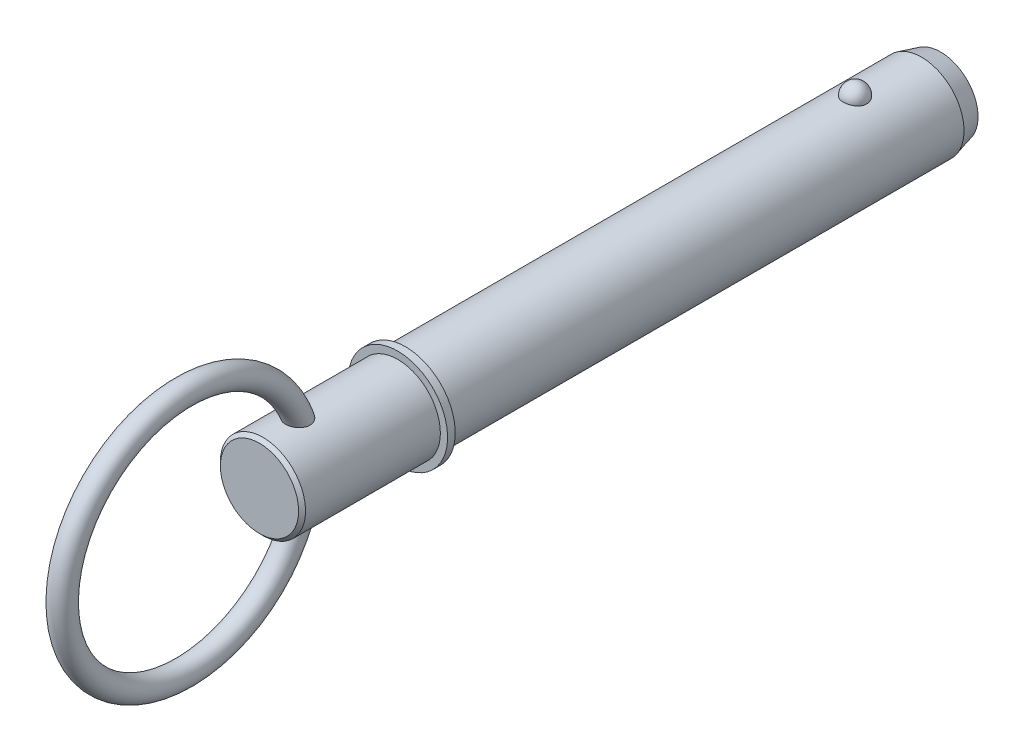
SolidWorks part; units mm, degrees
ref_plane "Front Plane" through (0, 0, 0) normal (0, 0, 1) x (1, 0, 0)
ref_plane "Top Plane" through (0, 0, 0) normal (0, 1, 0) x (1, 0, 0)
ref_plane "Right Plane" through (0, 0, 0) normal (1, 0, 0) x (0, 0, -1)
sketch "Sketch2" plane through (0, 0, 0) normal (0, 0, 1) x (1, 0, 0)
  circle A0 centre (0, 0) radius 11.115
  point P3 (0, 11.115)
  dimension "D1" = 22.23
extrude "Boss-Extrude1" add sketch "Sketch2" along normal blind 114.3
sketch "Sketch3" plane through (0, 0, 0) normal (0, 0, -1) x (-1, 0, 0)
  circle A0 centre (0, 0) radius 11.115
  dimension "D1" = 22.23
extrude "Boss-Extrude2" add sketch "Sketch3" along normal blind 25.4
chamfer "Chamfer1" distance 5 angle 15 1 edges at (-11.115, 0, -25.4)
sketch "Sketch18" plane through (0, 0, 0) normal (1, 0, 0) x (0, 0, -1)
  line L0 (20.4, 11.115) -> (-114.3, 11.115) construction
  line L1 (3.07, 14.185) -> (3.07, 8.045)
  line L2 (-114.3, -11.115) -> (20.4, -11.115) construction
  arc A0 (3.07, 14.185) -> (3.07, 8.045) centre (3.07, 11.115) ccw
  point P4 (0, 11.115)
  dimension "D1" = 25.3
revolve "Revolve1" add sketch "Sketch18" angle 360 about L1
sketch "Sketch19" plane through (0, 0, 0) normal (1, 0, 0) x (0, 0, -1)
  line L0 (-33.7288, 0) -> (-46.4542, 0) construction
sketch "Sketch20" plane through (0, 0, 0) normal (1, 0, 0) x (0, 0, -1)
  line L0 (-114.3, 0) -> (-114.3, 13)
  line L1 (-114.3, 11.115) -> (-114.3, -11.115) construction
  line L2 (-114.3, 13) -> (-116.3, 13)
  line L3 (-116.3, 13) -> (-116.3, 0)
  line L4 (-33.7288, 0) -> (-46.4542, 0) construction
  line L5 (-116.3, 0) -> (-114.3, 0)
  dimension "D1" = 13
  dimension "D2" = 2
revolve "Revolve2" add sketch "Sketch20" angle 360 about L0
sketch "Sketch21" plane through (0, 0, 114.3) normal (0, 0, -1) x (-1, 0, 0)
  circle A0 centre (0, 0) radius 11.115
  dimension "D1" = 22.23
extrude "Boss-Extrude3" add sketch "Sketch21" against normal blind 38.1
chamfer "Chamfer2" distance 0.9 angle 45 1 edges at (-11.115, 0, 152.4)
sketch "Sketch23" plane through (0, 0, 0) normal (1, 0, 0) x (0, 0, -1)
  line L0 (-152.4, 10.215) -> (-152.4, -10.215) construction
  circle A0 centre (-172.15, 0) radius 31.75
  point P2 (-140.4, 0)
  dimension "D1" = 63.5
  dimension "D2" = 12
sketch "Sketch24" plane through (0, 0, 0) normal (0, 1, 0) x (1, 0, 0)
  circle A0 centre (0, -140.4) radius 3
  dimension "D1" = 6
sweep "Sweep1" add profiles "Sketch24" path "Sketch23"
